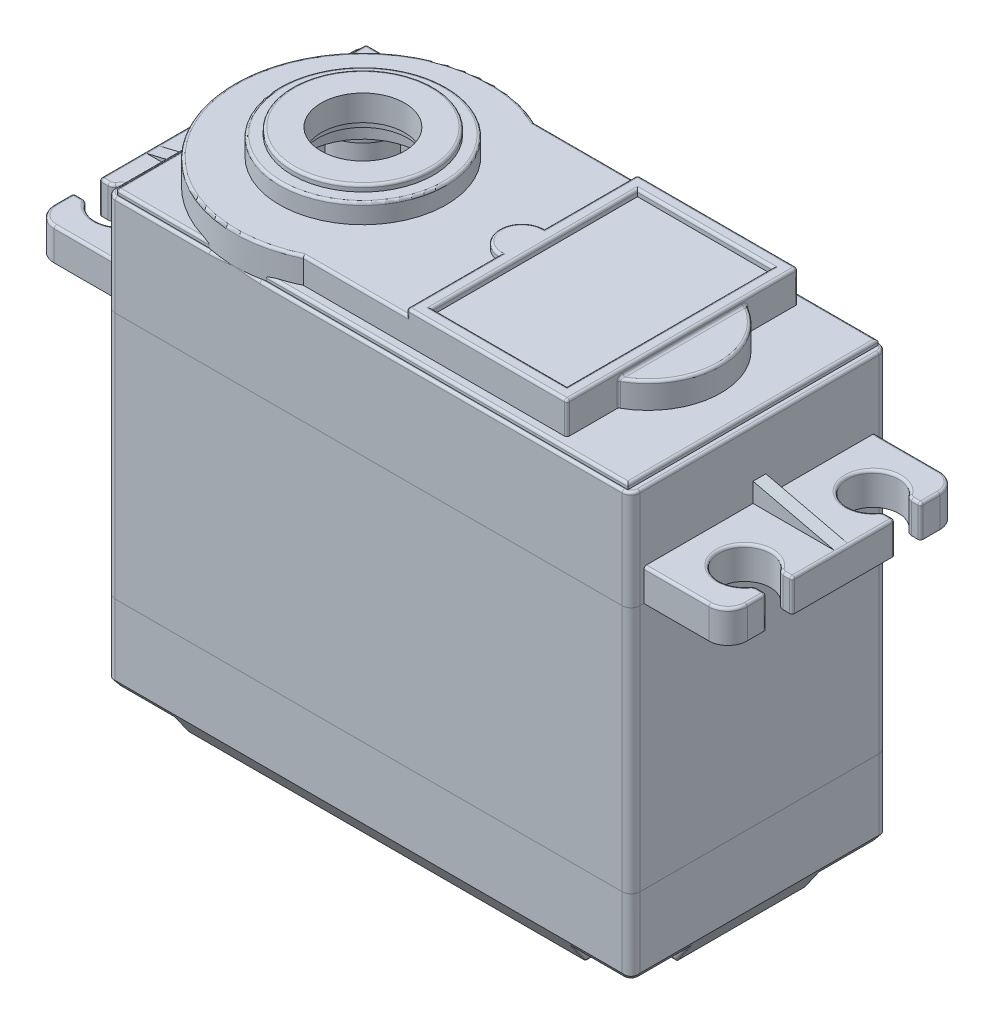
SolidWorks part; units mm, degrees
ref_plane "Front Plane" through (0, 0, 0) normal (0, 0, 1) x (1, 0, 0)
ref_plane "Top Plane" through (0, 0, 0) normal (0, 1, 0) x (1, 0, 0)
ref_plane "Right Plane" through (0, 0, 0) normal (1, 0, 0) x (0, 0, -1)
sketch "Sketch2" plane through (0, 0, 0) normal (0, 1, 0) x (1, 0, 0)
  line L1 (20.45, -10) -> (-20.45, -10)
  line L2 (20.45, -10) -> (20.45, 10)
  line L3 (20.45, 10) -> (-20.45, 10)
  line L4 (-20.45, -10) -> (-20.45, 10)
  line L5 (20.45, -10) -> (-20.45, 10) construction
  line L6 (20.45, 10) -> (-20.45, -10) construction
  point P0 (0, 0)
extrude "Boss-Extrude2" add sketch "Sketch2" along normal mid plane 19.3
sketch "Sketch11" plane through (0, 9.65, 0) normal (0, 1, 0) x (1, 0, 0)
  line L4 (-20.45, 10) -> (-20.45, -10)
  line L5 (-20.45, -10) -> (20.45, -10)
  line L6 (20.45, -10) -> (20.45, 10)
  line L7 (20.45, 10) -> (-20.45, 10)
  line L8 (-20.45, 10) -> (-20.45, -10)
  line L9 (-20.45, -10) -> (20.45, -10)
  line L10 (20.45, -10) -> (20.45, 10)
  line L11 (20.45, 10) -> (-20.45, 10)
  dimension "D1" = 0
extrude "Boss-Extrude10" add sketch "Sketch11" along normal blind 6.8 separate body
sketch "Sketch12" plane through (0, -9.65, 0) normal (0, -1, 0) x (1, 0, 0)
  line L4 (-20.45, 10) -> (-20.45, -10)
  line L5 (-20.45, -10) -> (20.45, -10)
  line L6 (20.45, -10) -> (20.45, 10)
  line L7 (20.45, 10) -> (-20.45, 10)
  line L8 (-20.45, 10) -> (-20.45, -10)
  line L9 (-20.45, -10) -> (20.45, -10)
  line L10 (20.45, -10) -> (20.45, 10)
  line L11 (20.45, 10) -> (-20.45, 10)
  dimension "D1" = 0
extrude "Boss-Extrude11" add sketch "Sketch12" along normal blind 8.5 separate body
chamfer "Chamfer1" distance 2 angle 35 4 edges at (20.45, -18.15, 0) (0, -18.15, -10) (-20.45, -18.15, 0) (0, -18.15, 10)
sketch "Sketch13" plane through (0, -18.15, 0) normal (0, -1, 0) x (1, 0, 0)
  line L0 (-20.45, 10) -> (20.45, 10) construction
  line L1 (-17.575, -7.125) -> (17.575, -7.125) construction
  line L2 (-17.575, -7.125) -> (-17.575, 7.125) construction
  line L3 (-17.575, 7.125) -> (17.575, 7.125) construction
  line L4 (17.575, -7.125) -> (17.575, 7.125) construction
  line L5 (-17.575, -7.125) -> (17.575, 7.125) construction
  line L6 (-17.575, 7.125) -> (17.575, -7.125) construction
  line L11 (0, 10) -> (0, -10) construction
  line L12 (20.45, -10) -> (-20.45, -10) construction
  line L13 (-20.45, 10) -> (-15.575, 10)
  line L14 (-20.45, 10) -> (-20.45, 5.125)
  line L15 (-20.45, 5.125) -> (-17.575, 5.125)
  line L16 (-15.575, 10) -> (-15.575, 7.125)
  line L17 (-15.575, 6.3142) -> (-15.575, 5.125) construction
  line L18 (-17.575, 5.125) -> (-15.575, 5.125) construction
  line L23 (-20.45, 0) -> (20.45, 0) construction
  line L24 (20.45, 10) -> (20.45, -10) construction
  line L29 (20.45, 10) -> (20.45, 5.125)
  line L30 (20.45, 5.125) -> (17.575, 5.125)
  line L31 (-20.45, -10) -> (-20.45, 10) construction
  line L32 (-15.575, 7.125) -> (-15.575, 6.3142) construction
  line L33 (15.575, 10) -> (15.575, 7.125)
  line L34 (20.45, 10) -> (15.575, 10)
  line L35 (20.45, -10) -> (15.575, -10)
  line L36 (15.575, -10) -> (15.575, -7.125)
  line L37 (20.45, -5.125) -> (17.575, -5.125)
  line L38 (20.45, -10) -> (20.45, -5.125)
  line L39 (-20.45, -10) -> (-20.45, -5.125)
  line L40 (-20.45, -5.125) -> (-17.575, -5.125)
  line L41 (-15.575, -10) -> (-15.575, -7.125)
  line L42 (-20.45, -10) -> (-15.575, -10)
  circle A0 centre (-17.575, 7.125) radius 1.125 construction
  circle A1 centre (-17.575, 7.125) radius 1.6 construction
  arc A2 (-17.575, 5.125) -> (-15.575, 7.125) centre (-17.575, 7.125) ccw
  arc A3 (-15.575, 7.125) -> (-17.575, 5.125) centre (-17.575, 7.125) ccw construction
  arc A4 (17.575, 5.125) -> (15.575, 7.125) centre (17.575, 7.125) cw
  arc A5 (17.575, -5.125) -> (15.575, -7.125) centre (17.575, -7.125) ccw
  arc A6 (-17.575, -5.125) -> (-15.575, -7.125) centre (-17.575, -7.125) cw
  point P0 (0, 0)
  point P15 (0, 0)
  point P20 (0, 0)
  dimension "D1" = 1.75
  dimension "D2" = 2.25
  dimension "D3" = 3.2
  dimension "D4" = 1.75
  dimension "D5" = 4
extrude "Cut-Extrude1" cut sketch "Sketch13" against normal blind 1.5
sketch "Sketch14" plane through (0, -16.65, 0) normal (0, -1, 0) x (1, 0, 0)
  line L20 (0, 10) -> (0, -10) construction
  line L21 (20.45, -10) -> (-20.45, -10) construction
  line L22 (-20.45, 0) -> (20.45, 0) construction
  line L23 (20.45, 10) -> (20.45, -10) construction
  circle A4 centre (-17.575, 7.125) radius 1.125
  circle A5 centre (17.575, 7.125) radius 1.125
  circle A6 centre (17.575, -7.125) radius 1.125
  circle A7 centre (-17.575, -7.125) radius 1.125
  point P4 (0, 0)
  point P16 (0, 0)
  dimension "D1" = 2.25
extrude "Cut-Extrude2" cut sketch "Sketch14" against normal offset from surface (30.1 mm away) 3
sketch "Sketch25" plane through (0, 16.45, 0) normal (0, 1, 0) x (1, 0, 0)
  line L0 (20.45, 10) -> (-20.45, 10) construction
  line L1 (19.95, -9.75) -> (-19.95, -9.75)
  line L2 (19.95, -9.75) -> (19.95, 9.75)
  line L3 (19.95, 9.75) -> (-19.95, 9.75)
  line L4 (-19.95, -9.75) -> (-19.95, 9.75)
  line L5 (19.95, -9.75) -> (-19.95, 9.75) construction
  line L6 (19.95, 9.75) -> (-19.95, -9.75) construction
  line L7 (-20.45, 10) -> (-20.45, -10) construction
  point P0 (0, 0)
  dimension "D1" = 0.25
  dimension "D2" = 0.5
extrude "Boss-Extrude12" add sketch "Sketch25" along normal blind 0.4
sketch "Sketch26" plane through (0, 16.85, 0) normal (0, 1, 0) x (1, 0, 0)
  line L0 (20.45, 0) -> (-20.45, 0) construction
  line L5 (14.45, 9) -> (-6.0911, 9)
  line L6 (14.45, -9) -> (-6.0911, -9)
  line L7 (14.45, 9) -> (14.45, 5)
  line L8 (14.45, -9) -> (14.45, -5)
  line L10 (20.45, -10) -> (20.45, 10) construction
  line L11 (-20.45, -10) -> (20.45, -10) construction
  line L13 (-20.45, 10) -> (-20.45, -10) construction
  arc A2 (-6.0911, 9) -> (-6.0911, -9) centre (-10.45, 0) ccw
  arc A3 (14.45, 5) -> (14.45, -5) centre (11.7833, 0) cw
  point P3 (0, 0)
  point P11 (17.45, 0)
  point P18 (20.45, 0)
extrude "Boss-Extrude13" add sketch "Sketch26" along normal blind 2 and the other way up to surface
sketch "Sketch27" plane through (0, 18.85, 0) normal (0, 1, 0) x (1, 0, 0)
  circle A0 centre (-10.45, 0) radius 6.5
  dimension "D1" = 13
extrude "Boss-Extrude14" add sketch "Sketch27" along normal blind 1.5
sketch "Sketch28" plane through (0, 20.35, 0) normal (0, 1, 0) x (1, 0, 0)
  circle A0 centre (-10.45, 0) radius 5.5
  dimension "D1" = 11
extrude "Boss-Extrude15" add sketch "Sketch28" along normal blind 0.5
sketch "Sketch29" plane through (0, 18.85, 0) normal (0, 1, 0) x (1, 0, 0)
  line L0 (-6.0911, -9) -> (14.45, -9) construction
  line L1 (14.45, 9) -> (1.95, 9)
  line L2 (14.45, 9) -> (14.45, -9)
  line L3 (14.45, -9) -> (1.95, -9)
  line L4 (1.95, 9) -> (1.95, 1.75)
  line L5 (2.95, 8) -> (2.95, -8)
  line L6 (13.45, -8) -> (2.95, -8)
  line L7 (13.45, 8) -> (13.45, -8)
  line L8 (13.45, 8) -> (2.95, 8)
  line L9 (1.95, 1.75) -> (1.95, -1.75) construction
  line L10 (1.95, -1.75) -> (1.95, -9)
  line L11 (1.95, 9) -> (1.95, -9) construction
  arc A1 (1.95, -1.75) -> (1.95, 1.75) centre (1.95, 0) cw
  point P19 (1.95, 0)
  dimension "D2" = 3.5
  dimension "D1" = 12.5
  dimension "D3" = 1
extrude "Boss-Extrude16" add sketch "Sketch29" along normal blind 0.5
fillet "Fillet9" radius 0.2 39 edges at (14.45, 17.85, 5) (14.45, 17.85, -5) (14.45, 18.85, 0) (-20.45, 16.45, -5) (-15.45, 16.45, -10) (-15.45, 16.45, 10) (2.95, 19.35, 0) (8.2, 19.35, 8) (13.45, 19.35, 0) (8.2, 19.35, -8) (8.2, 19.35, 9) (1.95, 19.35, 5.375) (0.2, 19.35, 0) (1.95, 19.35, -5.375) (8.2, 19.35, -9) (14.45, 19.35, 0) (-10.45, 20.35, 6.5) (-10.45, 20.85, 5.5) (1.95, 19.1, 9) (1.95, 19.1, -9) (-16.311, 16.85, -9.75) (-19.95, 16.65, 9.75) (-16.311, 16.85, 9.75) (-19.95, 16.65, -9.75) (-19.95, 16.85, -6.4362) (-19.95, 16.85, 6.4362) (-20.45, 16.45, 5) (-2.0706, 18.85, 9) (-20.45, 18.85, 0) (-2.0706, 18.85, -9) (14.45, 18.1, -9) (14.45, 18.1, 9) (17.45, 18.85, 0) (5, 16.45, -10) (5.861, 16.85, -9.75) (20.45, 16.45, 0) (5, 16.45, 10) (5.861, 16.85, 9.75) (19.95, 16.85, 0)
fillet "Fillet10" radius 0.7 8 edges at (20.3914, 16.3914, 9.9414) (-20.3914, 16.3914, 9.9414) (20.3914, 16.3914, -9.9414) (-20.3914, 16.3914, -9.9414) (-20.45, 12.95, -10) (20.45, 12.95, -10) (-20.45, 12.95, 10) (20.45, 12.95, 10)
fillet "Fillet11" radius 0.7 4 edges at (-20.45, 0, 10) (20.45, 0, -10) (-20.45, 0, -10) (20.45, 0, 10)
fillet "Fillet12" radius 0.7 8 edges at (-20.45, -12.9, 10) (-20.45, -12.9, -10) (20.45, -12.9, -10) (20.45, -12.9, 10) (-20.2749, -16.4, -9.8249) (-20.2749, -16.4, 9.8249) (20.2749, -16.4, -9.8249) (20.2749, -16.4, 9.8249)
shell "Shell1" thickness 2
sketch "Sketch45" plane through (0, -9.65, 0) normal (0, 1, 0) x (1, 0, 0)
  line L1 (-15.5021, 8) -> (-14.575, 8)
  line L2 (-18.45, 5.0521) -> (-18.45, 4.125)
  line L5 (-18.45, -4.125) -> (-18.45, 4.125) construction
  line L6 (-14.575, 8) -> (14.575, 8) construction
  line L8 (0, 10) -> (0, -10) construction
  line L10 (19.75, -10) -> (-19.75, -10) construction
  line L14 (-20.45, 0) -> (20.45, 0) construction
  line L16 (20.45, 9.3) -> (20.45, -9.3) construction
  line L18 (18.45, 5.0521) -> (18.45, 4.125)
  line L20 (-18.45, 8) -> (-18.2821, 8) construction
  line L21 (-18.45, 8) -> (-18.45, 7.8321) construction
  line L22 (-18.2821, 8) -> (-16.8679, 8) construction
  line L23 (-18.45, 7.8321) -> (-18.45, 6.4179) construction
  line L24 (-16.8679, 8) -> (-15.5021, 8) construction
  line L25 (-18.45, 6.4179) -> (-18.45, 5.0521) construction
  line L32 (15.5021, 8) -> (14.575, 8)
  line L40 (18.45, -5.0521) -> (18.45, -4.125)
  line L41 (15.5021, -8) -> (14.575, -8)
  line L42 (-18.45, -5.0521) -> (-18.45, -4.125)
  line L43 (-15.5021, -8) -> (-14.575, -8)
  arc A7 (-18.45, 6.4179) -> (-16.8679, 8) centre (-17.575, 7.125) ccw construction
  arc A8 (-18.45, 5.0521) -> (-15.5021, 8) centre (-17.575, 7.125) ccw
  arc A20 (18.45, 4.125) -> (14.575, 8) centre (17.575, 7.125) cw
  arc A21 (18.45, 5.0521) -> (15.5021, 8) centre (17.575, 7.125) cw
  arc A23 (18.45, -5.0521) -> (15.5021, -8) centre (17.575, -7.125) ccw
  arc A26 (-15.5021, 8) -> (-18.45, 5.0521) centre (-17.575, 7.125) ccw construction
  circle A27 centre (-17.575, 7.125) radius 2.25 construction
  arc A28 (-16.8679, 8) -> (-18.2821, 8) centre (-17.575, 7.125) ccw construction
  circle A29 centre (-17.575, 7.125) radius 1.125 construction
  arc A30 (-18.2821, 8) -> (-18.45, 7.8321) centre (-17.575, 7.125) ccw construction
  arc A31 (-18.45, 7.8321) -> (-18.45, 6.4179) centre (-17.575, 7.125) ccw construction
  arc A33 (18.45, -4.125) -> (14.575, -8) centre (17.575, -7.125) ccw
  arc A35 (-18.45, -4.125) -> (-14.575, -8) centre (-17.575, -7.125) cw
  arc A39 (-18.45, -5.0521) -> (-15.5021, -8) centre (-17.575, -7.125) cw
  arc A46 (-18.45, 4.125) -> (-14.575, 8) centre (-17.575, 7.125) ccw construction
  arc A47 (-18.45, 4.125) -> (-14.575, 8) centre (-17.575, 7.125) ccw
  circle A52 centre (-17.575, 7.125) radius 1.125 construction
  point P5 (0, 0)
  point P14 (0, 0)
  dimension "D1" = 1.125
extrude "Cut-Extrude7" cut sketch "Sketch45" against normal up to surface (5 mm away)
sketch "Sketch32" plane through (0, -9.65, 0) normal (0, 1, 0) x (1, 0, 0)
  line L16 (-19.75, 10) -> (19.75, 10) construction
  line L17 (-18.975, 9.125) -> (18.975, 9.125)
  line L18 (-19.575, 8.525) -> (-19.575, -8.525)
  line L19 (-18.975, -9.125) -> (18.975, -9.125)
  line L20 (19.575, 8.525) -> (19.575, -8.525)
  line L21 (-20.45, -9.3) -> (-20.45, 9.3) construction
  line L26 (-20.45, 9.3) -> (-20.45, -9.3)
  line L27 (-19.75, -10) -> (19.75, -10)
  line L28 (20.45, -9.3) -> (20.45, 9.3)
  line L29 (19.75, 10) -> (-19.75, 10)
  line L30 (-20.45, 9.3) -> (-20.45, -9.3)
  line L31 (-19.75, -10) -> (19.75, -10)
  line L32 (20.45, -9.3) -> (20.45, 9.3)
  line L33 (19.75, 10) -> (-19.75, 10)
  arc A41 (18.975, -9.125) -> (19.575, -8.525) centre (18.975, -8.525) ccw
  arc A42 (-19.575, -8.525) -> (-18.975, -9.125) centre (-18.975, -8.525) ccw
  arc A43 (18.975, 9.125) -> (19.575, 8.525) centre (18.975, 8.525) cw
  arc A44 (-18.975, 9.125) -> (-19.575, 8.525) centre (-18.975, 8.525) ccw
  arc A49 (-20.45, -9.3) -> (-19.75, -10) centre (-19.75, -9.3) ccw
  arc A51 (-20.45, -9.3) -> (-19.75, -10) centre (-19.75, -9.3) ccw
  arc A57 (19.75, -10) -> (20.45, -9.3) centre (19.75, -9.3) ccw
  arc A59 (19.75, -10) -> (20.45, -9.3) centre (19.75, -9.3) ccw
  arc A61 (20.45, 9.3) -> (19.75, 10) centre (19.75, 9.3) ccw
  arc A62 (20.45, 9.3) -> (19.75, 10) centre (19.75, 9.3) ccw
  arc A63 (-19.75, 10) -> (-20.45, 9.3) centre (-19.75, 9.3) ccw
  arc A64 (-19.75, 10) -> (-20.45, 9.3) centre (-19.75, 9.3) ccw
  point P10 (0, 9.125)
  point P11 (19.575, 0)
  dimension "D3" = 0.6
  dimension "D1" = 0.875
  dimension "D2" = 0.875
  dimension "D4" = 0
extrude "Cut-Extrude6" cut sketch "Sketch32" against normal blind 1
shell "Shell2" thickness 2
sketch "Sketch36" plane through (0, 9.65, 0) normal (0, 1, 0) x (1, 0, 0)
  line L0 (-15.5021, 8) -> (15.5021, 8)
  line L1 (-18.45, 5.0521) -> (-18.45, -5.0521)
  line L2 (-15.5021, -8) -> (15.5021, -8)
  line L3 (18.45, 5.0521) -> (18.45, -5.0521)
  line L20 (18.975, 9.125) -> (-18.975, 9.125)
  line L21 (19.575, -8.525) -> (19.575, 8.525)
  line L22 (-18.975, -9.125) -> (18.975, -9.125)
  line L23 (-19.575, 8.525) -> (-19.575, -8.525)
  line L24 (18.975, 9.125) -> (-18.975, 9.125)
  line L25 (19.575, -8.525) -> (19.575, 8.525)
  line L26 (-18.975, -9.125) -> (18.975, -9.125)
  line L27 (-19.575, 8.525) -> (-19.575, -8.525)
  line L28 (19.75, 10) -> (-19.75, 10)
  line L29 (-20.45, 9.3) -> (-20.45, -9.3)
  line L30 (-19.75, -10) -> (19.75, -10)
  line L31 (20.45, -9.3) -> (20.45, 9.3)
  line L32 (19.75, 10) -> (-19.75, 10)
  line L33 (-20.45, 9.3) -> (-20.45, -9.3)
  line L34 (-19.75, -10) -> (19.75, -10)
  line L35 (20.45, -9.3) -> (20.45, 9.3)
  arc A0 (-18.45, 5.0521) -> (-15.5021, 8) centre (-17.575, 7.125) ccw construction
  arc A1 (-18.45, 5.0521) -> (-15.5021, 8) centre (-17.575, 7.125) ccw
  arc A4 (19.575, 8.525) -> (18.975, 9.125) centre (18.975, 8.525) ccw
  arc A5 (18.975, -9.125) -> (19.575, -8.525) centre (18.975, -8.525) ccw
  arc A6 (-19.575, -8.525) -> (-18.975, -9.125) centre (-18.975, -8.525) ccw
  arc A7 (-18.975, 9.125) -> (-19.575, 8.525) centre (-18.975, 8.525) ccw
  arc A8 (19.575, 8.525) -> (18.975, 9.125) centre (18.975, 8.525) ccw
  arc A9 (18.975, -9.125) -> (19.575, -8.525) centre (18.975, -8.525) ccw
  arc A10 (-19.575, -8.525) -> (-18.975, -9.125) centre (-18.975, -8.525) ccw
  arc A11 (-18.975, 9.125) -> (-19.575, 8.525) centre (-18.975, 8.525) ccw
  arc A80 (-15.5021, -8) -> (-18.45, -5.0521) centre (-17.575, -7.125) ccw construction
  arc A81 (-15.5021, -8) -> (-18.45, -5.0521) centre (-17.575, -7.125) ccw
  arc A82 (15.5021, 8) -> (18.45, 5.0521) centre (17.575, 7.125) ccw construction
  arc A83 (15.5021, 8) -> (18.45, 5.0521) centre (17.575, 7.125) ccw
  arc A84 (18.45, -5.0521) -> (15.5021, -8) centre (17.575, -7.125) ccw construction
  arc A85 (18.45, -5.0521) -> (15.5021, -8) centre (17.575, -7.125) ccw
  arc A86 (-19.75, 10) -> (-20.45, 9.3) centre (-19.75, 9.3) ccw
  arc A88 (-19.75, 10) -> (-20.45, 9.3) centre (-19.75, 9.3) ccw
  arc A90 (-20.45, -9.3) -> (-19.75, -10) centre (-19.75, -9.3) ccw
  arc A92 (-20.45, -9.3) -> (-19.75, -10) centre (-19.75, -9.3) ccw
  arc A94 (19.75, -10) -> (20.45, -9.3) centre (19.75, -9.3) ccw
  arc A95 (19.75, -10) -> (20.45, -9.3) centre (19.75, -9.3) ccw
  arc A96 (20.45, 9.3) -> (19.75, 10) centre (19.75, 9.3) ccw
  arc A97 (20.45, 9.3) -> (19.75, 10) centre (19.75, 9.3) ccw
  dimension "D1" = 0
  dimension "D2" = 0
extrude "Cut-Extrude3" cut sketch "Sketch36" against normal blind 1
sketch "Sketch47" plane through (0, -9.65, 0) normal (0, -1, 0) x (1, 0, 0)
  line L3 (18.45, 4.125) -> (18.45, 5.0521)
  line L7 (15.5021, 8) -> (14.575, 8)
  line L11 (18.45, 4.125) -> (18.45, 5.0521)
  line L15 (15.5021, 8) -> (14.575, 8)
  line L18 (18.45, -5.0521) -> (18.45, -4.125)
  line L19 (14.575, -8) -> (15.5021, -8)
  line L20 (18.45, -5.0521) -> (18.45, -4.125)
  line L21 (14.575, -8) -> (15.5021, -8)
  line L22 (-18.45, 5.0521) -> (-18.45, 4.125)
  line L23 (-14.575, 8) -> (-15.5021, 8)
  line L24 (-18.45, 5.0521) -> (-18.45, 4.125)
  line L25 (-14.575, 8) -> (-15.5021, 8)
  line L26 (-15.5021, -8) -> (-14.575, -8)
  line L27 (-18.45, -4.125) -> (-18.45, -5.0521)
  line L28 (-15.5021, -8) -> (-14.575, -8)
  line L29 (-18.45, -4.125) -> (-18.45, -5.0521)
  arc A19 (14.575, 8) -> (18.45, 4.125) centre (17.575, 7.125) ccw
  arc A20 (15.5021, 8) -> (18.45, 5.0521) centre (17.575, 7.125) ccw
  arc A21 (14.575, 8) -> (18.45, 4.125) centre (17.575, 7.125) ccw
  arc A22 (15.5021, 8) -> (18.45, 5.0521) centre (17.575, 7.125) ccw
  arc A23 (18.45, -4.125) -> (14.575, -8) centre (17.575, -7.125) ccw
  arc A24 (18.45, -5.0521) -> (15.5021, -8) centre (17.575, -7.125) ccw
  arc A25 (18.45, -4.125) -> (14.575, -8) centre (17.575, -7.125) ccw
  arc A26 (18.45, -5.0521) -> (15.5021, -8) centre (17.575, -7.125) ccw
  arc A27 (-18.45, 4.125) -> (-14.575, 8) centre (-17.575, 7.125) ccw
  arc A28 (-18.45, 5.0521) -> (-15.5021, 8) centre (-17.575, 7.125) ccw
  arc A29 (-18.45, 4.125) -> (-14.575, 8) centre (-17.575, 7.125) ccw
  arc A30 (-18.45, 5.0521) -> (-15.5021, 8) centre (-17.575, 7.125) ccw
  arc A31 (-14.575, -8) -> (-18.45, -4.125) centre (-17.575, -7.125) ccw
  arc A32 (-15.5021, -8) -> (-18.45, -5.0521) centre (-17.575, -7.125) ccw
  arc A33 (-14.575, -8) -> (-18.45, -4.125) centre (-17.575, -7.125) ccw
  arc A34 (-15.5021, -8) -> (-18.45, -5.0521) centre (-17.575, -7.125) ccw
  dimension "D1" = 0
  dimension "D2" = 0
  dimension "D3" = 0
  dimension "D4" = 0
extrude "Cut-Extrude9" cut sketch "Sketch47" against normal up to surface (17.3 mm away)
sketch "Sketch37" plane through (0, -9.65, 0) normal (0, -1, 0) x (1, 0, 0)
  line L12 (-18.975, -9.125) -> (18.975, -9.125)
  line L13 (19.575, -8.525) -> (19.575, 8.525)
  line L14 (18.975, 9.125) -> (-18.975, 9.125)
  line L15 (-19.575, 8.525) -> (-19.575, -8.525)
  line L16 (-18.975, -9.125) -> (18.975, -9.125)
  line L17 (19.575, -8.525) -> (19.575, 8.525)
  line L18 (18.975, 9.125) -> (-18.975, 9.125)
  line L19 (-19.575, 8.525) -> (-19.575, -8.525)
  line L20 (-19.75, -10) -> (19.75, -10)
  line L21 (-20.45, 9.3) -> (-20.45, -9.3)
  line L22 (19.75, 10) -> (-19.75, 10)
  line L23 (20.45, -9.3) -> (20.45, 9.3)
  line L24 (-19.75, -10) -> (19.75, -10)
  line L25 (-20.45, 9.3) -> (-20.45, -9.3)
  line L26 (19.75, 10) -> (-19.75, 10)
  line L27 (20.45, -9.3) -> (20.45, 9.3)
  arc A4 (18.975, -9.125) -> (19.575, -8.525) centre (18.975, -8.525) ccw
  arc A5 (19.575, 8.525) -> (18.975, 9.125) centre (18.975, 8.525) ccw
  arc A6 (-18.975, 9.125) -> (-19.575, 8.525) centre (-18.975, 8.525) ccw
  arc A7 (-19.575, -8.525) -> (-18.975, -9.125) centre (-18.975, -8.525) ccw
  arc A8 (18.975, -9.125) -> (19.575, -8.525) centre (18.975, -8.525) ccw
  arc A9 (19.575, 8.525) -> (18.975, 9.125) centre (18.975, 8.525) ccw
  arc A10 (-18.975, 9.125) -> (-19.575, 8.525) centre (-18.975, 8.525) ccw
  arc A11 (-19.575, -8.525) -> (-18.975, -9.125) centre (-18.975, -8.525) ccw
  arc A36 (-20.45, -9.3) -> (-19.75, -10) centre (-19.75, -9.3) ccw
  arc A38 (-20.45, -9.3) -> (-19.75, -10) centre (-19.75, -9.3) ccw
  arc A44 (-19.75, 10) -> (-20.45, 9.3) centre (-19.75, 9.3) ccw
  arc A46 (-19.75, 10) -> (-20.45, 9.3) centre (-19.75, 9.3) ccw
  arc A48 (20.45, 9.3) -> (19.75, 10) centre (19.75, 9.3) ccw
  arc A49 (20.45, 9.3) -> (19.75, 10) centre (19.75, 9.3) ccw
  arc A50 (19.75, -10) -> (20.45, -9.3) centre (19.75, -9.3) ccw
  arc A51 (19.75, -10) -> (20.45, -9.3) centre (19.75, -9.3) ccw
  dimension "D1" = 0
  dimension "D2" = 0
extrude "Boss-Extrude24" add sketch "Sketch37" along normal blind 1
shell "Shell3" thickness 2
sketch "Sketch50" plane through (0, 9.65, 0) normal (0, -1, 0) x (1, 0, 0)
  line L3 (18.45, 4.125) -> (18.45, 5.0521)
  line L7 (15.5021, 8) -> (14.575, 8)
  line L11 (18.45, 4.125) -> (18.45, 5.0521)
  line L15 (15.5021, 8) -> (14.575, 8)
  line L18 (18.45, -5.0521) -> (18.45, -4.125)
  line L19 (14.575, -8) -> (15.5021, -8)
  line L20 (18.45, -5.0521) -> (18.45, -4.125)
  line L21 (14.575, -8) -> (15.5021, -8)
  line L22 (-18.45, 5.0521) -> (-18.45, 4.125)
  line L23 (-14.575, 8) -> (-15.5021, 8)
  line L24 (-18.45, 5.0521) -> (-18.45, 4.125)
  line L25 (-14.575, 8) -> (-15.5021, 8)
  line L26 (-15.5021, -8) -> (-14.575, -8)
  line L27 (-18.45, -4.125) -> (-18.45, -5.0521)
  line L28 (-15.5021, -8) -> (-14.575, -8)
  line L29 (-18.45, -4.125) -> (-18.45, -5.0521)
  arc A19 (14.575, 8) -> (18.45, 4.125) centre (17.575, 7.125) ccw
  arc A20 (15.5021, 8) -> (18.45, 5.0521) centre (17.575, 7.125) ccw
  arc A21 (14.575, 8) -> (18.45, 4.125) centre (17.575, 7.125) ccw
  arc A22 (15.5021, 8) -> (18.45, 5.0521) centre (17.575, 7.125) ccw
  arc A23 (18.45, -4.125) -> (14.575, -8) centre (17.575, -7.125) ccw
  arc A24 (18.45, -5.0521) -> (15.5021, -8) centre (17.575, -7.125) ccw
  arc A25 (18.45, -4.125) -> (14.575, -8) centre (17.575, -7.125) ccw
  arc A26 (18.45, -5.0521) -> (15.5021, -8) centre (17.575, -7.125) ccw
  arc A27 (-18.45, 4.125) -> (-14.575, 8) centre (-17.575, 7.125) ccw
  arc A28 (-18.45, 5.0521) -> (-15.5021, 8) centre (-17.575, 7.125) ccw
  arc A29 (-18.45, 4.125) -> (-14.575, 8) centre (-17.575, 7.125) ccw
  arc A30 (-18.45, 5.0521) -> (-15.5021, 8) centre (-17.575, 7.125) ccw
  arc A31 (-14.575, -8) -> (-18.45, -4.125) centre (-17.575, -7.125) ccw
  arc A32 (-15.5021, -8) -> (-18.45, -5.0521) centre (-17.575, -7.125) ccw
  arc A33 (-14.575, -8) -> (-18.45, -4.125) centre (-17.575, -7.125) ccw
  arc A34 (-15.5021, -8) -> (-18.45, -5.0521) centre (-17.575, -7.125) ccw
  dimension "D1" = 0
  dimension "D2" = 0
  dimension "D3" = 0
  dimension "D4" = 0
extrude "Cut-Extrude11" cut sketch "Sketch50" against normal up to surface (5.2 mm away)
sketch "Sketch39" plane through (0, 9.65, 0) normal (0, -1, 0) x (1, 0, 0)
  line L5 (-18.975, -9.125) -> (18.975, -9.125)
  line L6 (19.575, -8.525) -> (19.575, 8.525)
  line L7 (18.975, 9.125) -> (-18.975, 9.125)
  line L13 (-19.575, 8.525) -> (-19.575, -8.525)
  line L14 (-18.975, -9.125) -> (18.975, -9.125)
  line L15 (19.575, -8.525) -> (19.575, 8.525)
  line L20 (18.975, 9.125) -> (-18.975, 9.125)
  line L21 (-19.575, 8.525) -> (-19.575, -8.525)
  line L22 (19.75, 10) -> (-19.75, 10)
  line L23 (20.45, -9.3) -> (20.45, 9.3)
  line L24 (-19.75, -10) -> (19.75, -10)
  line L25 (-20.45, 9.3) -> (-20.45, -9.3)
  line L26 (19.75, 10) -> (-19.75, 10)
  line L27 (20.45, -9.3) -> (20.45, 9.3)
  line L28 (-19.75, -10) -> (19.75, -10)
  line L29 (-20.45, 9.3) -> (-20.45, -9.3)
  arc A4 (18.975, -9.125) -> (19.575, -8.525) centre (18.975, -8.525) ccw
  arc A5 (19.575, 8.525) -> (18.975, 9.125) centre (18.975, 8.525) ccw
  arc A6 (-18.975, 9.125) -> (-19.575, 8.525) centre (-18.975, 8.525) ccw
  arc A7 (-19.575, -8.525) -> (-18.975, -9.125) centre (-18.975, -8.525) ccw
  arc A8 (18.975, -9.125) -> (19.575, -8.525) centre (18.975, -8.525) ccw
  arc A9 (19.575, 8.525) -> (18.975, 9.125) centre (18.975, 8.525) ccw
  arc A10 (-18.975, 9.125) -> (-19.575, 8.525) centre (-18.975, 8.525) ccw
  arc A11 (-19.575, -8.525) -> (-18.975, -9.125) centre (-18.975, -8.525) ccw
  arc A20 (-19.75, 10) -> (-20.45, 9.3) centre (-19.75, 9.3) ccw
  arc A21 (-19.75, 10) -> (-20.45, 9.3) centre (-19.75, 9.3) ccw
  arc A22 (-20.45, -9.3) -> (-19.75, -10) centre (-19.75, -9.3) ccw
  arc A23 (-20.45, -9.3) -> (-19.75, -10) centre (-19.75, -9.3) ccw
  arc A24 (19.75, -10) -> (20.45, -9.3) centre (19.75, -9.3) ccw
  arc A25 (19.75, -10) -> (20.45, -9.3) centre (19.75, -9.3) ccw
  arc A26 (20.45, 9.3) -> (19.75, 10) centre (19.75, 9.3) ccw
  arc A27 (20.45, 9.3) -> (19.75, 10) centre (19.75, 9.3) ccw
  dimension "D1" = 0
  dimension "D2" = 0
extrude "Boss-Extrude22" add sketch "Sketch39" along normal blind 1
sketch "Sketch40" plane through (0, 20.85, 0) normal (0, 1, 0) x (1, 0, 0)
  circle A0 centre (-10.45, 0) radius 3.25
  dimension "D1" = 6.5
extrude "Cut-Extrude5" cut sketch "Sketch40" against normal up to next
sketch "Sketch8" plane through (0, 8.65, 6.75) normal (0, -1, 0) x (1, 0, 0)
  line L0 (20.45, -6.75) -> (0, -6.75) construction
  line L1 (20.45, 2.55) -> (20.45, -16.05) construction
  line L2 (20.45, 2.25) -> (25.5, 2.25)
  line L6 (25.5, -15.75) -> (20.45, -15.75)
  line L9 (20.45, -6.75) -> (27, -6.75) construction
  line L10 (20.45, -15.75) -> (20.45, 2.25)
  line L11 (24.3, -1.75) -> (24.3, -6.75) construction
  line L12 (24.3, -6.75) -> (24.3, -11.75) construction
  line L13 (27, 0.75) -> (27, -0.55)
  line L14 (26.3, -0.75) -> (26.8, -0.75)
  line L15 (26.3, -12.75) -> (26.8, -12.75)
  line L16 (26.3, -2.75) -> (26.8, -2.75)
  line L17 (26.3, -10.75) -> (26.8, -10.75)
  line L20 (27, -12.95) -> (27, -14.25)
  line L21 (27, -2.95) -> (27, -10.55)
  line L22 (0, 3.25) -> (0, -16.75) construction
  line L23 (-19.75, 3.25) -> (19.75, 3.25) construction
  line L24 (19.75, -16.75) -> (-19.75, -16.75) construction
  arc A0 (25.9, -0.55) -> (25.9, -2.95) centre (24.3, -1.75) ccw
  arc A1 (25.9, -10.55) -> (25.9, -12.95) centre (24.3, -11.75) ccw
  arc A2 (26.3, -12.75) -> (25.9, -12.95) centre (26.3, -13.25) ccw
  arc A3 (26.3, -10.75) -> (25.9, -10.55) centre (26.3, -10.25) cw
  arc A4 (26.3, -2.75) -> (25.9, -2.95) centre (26.3, -3.25) ccw
  arc A5 (26.3, -0.75) -> (25.9, -0.55) centre (26.3, -0.25) cw
  arc A6 (25.5, 2.25) -> (27, 0.75) centre (25.5, 0.75) cw
  arc A7 (27, -14.25) -> (25.5, -15.75) centre (25.5, -14.25) cw
  arc A8 (26.8, -12.75) -> (27, -12.95) centre (26.8, -12.95) cw
  arc A9 (26.8, -10.75) -> (27, -10.55) centre (26.8, -10.55) ccw
  arc A10 (26.8, -2.75) -> (27, -2.95) centre (26.8, -2.95) cw
  arc A11 (26.8, -0.75) -> (27, -0.55) centre (26.8, -0.55) ccw
  point P24 (20.45, -6.75)
  point P28 (26.0321, -12.75)
  point P31 (26.0321, -10.75)
  point P34 (26.0321, -2.75)
  point P37 (26.0321, -0.75)
  point P57 (27, -12.75)
  point P60 (27, -10.75)
  point P63 (27, -2.75)
  point P66 (27, -0.75)
extrude "Boss-Extrude8" add sketch "Sketch8" against normal blind 2.5
sketch "Sketch9" plane through (0, 0, 0) normal (0, 0, 1) x (1, 0, 0)
  line L0 (26.8, 11.15) -> (20.45, 12.65)
  line L4 (25.5, 11.15) -> (20.45, 11.15) construction
  line L5 (27, 11.15) -> (25.5, 11.15) construction
  dimension "D1" = 1.5
  dimension "D2" = 0.2
  dimension "D3" = 20.45
rib "Rib1" sketch "Sketch9" sketch "Sketch9" thickness 1 extrusion direction parallel to sketch draft on no parameters "D1"=1
fillet "Fillet22" radius 0.2 21 edges at (22.975, 11.15, -9) (26.5607, 11.15, -8.5607) (27, 11.15, -6.85) (26.9414, 11.15, -6.0586) (26.55, 11.15, -6) (26.0764, 11.15, -6.0528) (22.3, 11.15, -5) (26.0764, 11.15, -3.9472) (26.55, 11.15, -4) (26.9414, 11.15, -3.9414) (27, 11.15, 0) (26.9414, 11.15, 3.9414) (26.55, 11.15, 4) (26.0764, 11.15, 3.9472) (22.3, 11.15, 5) (26.0764, 11.15, 6.0528) (26.55, 11.15, 6) (26.9414, 11.15, 6.0586) (27, 11.15, 6.85) (26.5607, 11.15, 8.5607) (22.975, 11.15, 9)
mirror "Mirror1" about plane through (0, 0, 0) normal (1, 0, 0) of "Fillet22", "Rib1", "Boss-Extrude8"
sketch "Sketch48" plane through (0, 8.65, 0) normal (0, 1, 0) x (1, 0, 0)
  circle A0 centre (-10.45, 0) radius 1.75
  dimension "D1" = 3.5
extrude "Cut-Extrude10" cut sketch "Sketch48" against normal up to next
fillet "Fillet24" radius 0.2 35 edges at (20.0999, -16.65, 7.1007) (19.9419, -16.65, 9.4919) (15.575, -18.15, 7.8623) (16.1608, -18.15, 5.7108) (17.5507, -16.65, -9.6499) (19.9419, -16.65, -9.4919) (18.3123, -18.15, -5.125) (16.1608, -18.15, -5.7108) (-17.5507, -16.65, -9.6499) (-19.9419, -16.65, -9.4919) (-15.575, -18.15, -7.8623) (-18.3123, -18.15, -5.125) (-20.0999, -16.65, 7.1007) (-19.9419, -16.65, 9.4919) (-18.3123, -18.15, 5.125) (-16.1608, -18.15, 5.7108) (17.5507, -16.65, 9.6499) (15.575, -17.4, 9.1247) (18.3123, -18.15, 5.125) (19.5747, -17.4, 5.125) (20.0999, -16.65, -7.1007) (19.5747, -17.4, -5.125) (15.575, -18.15, -7.8623) (15.575, -17.4, -9.1247) (0, -18.15, -8.5996) (-15.575, -17.4, -9.1247) (-20.0999, -16.65, -7.1007) (-19.5747, -17.4, -5.125) (-16.1608, -18.15, -5.7108) (-17.5507, -16.65, 9.6499) (0, -18.15, 8.5996) (-19.0496, -18.15, 0) (-15.575, -17.4, 9.1247) (-19.5747, -17.4, 5.125) (-15.575, -18.15, 7.8623)
sketch "Sketch52" plane through (0, 9.65, 0) normal (0, -1, 0) x (1, 0, 0)
  circle A0 centre (-17.575, 7.125) radius 0.8
  circle A1 centre (17.575, 7.125) radius 0.8
  circle A2 centre (17.575, 7.125) radius 1.125 construction
  circle A3 centre (17.575, 7.125) radius 1.125
  circle A4 centre (-17.575, 7.125) radius 1.125 construction
  circle A5 centre (-17.575, 7.125) radius 1.125
  circle A6 centre (-17.575, -7.125) radius 1.125 construction
  circle A7 centre (-17.575, -7.125) radius 1.125
  circle A8 centre (-17.575, -7.125) radius 0.8
  circle A9 centre (17.575, -7.125) radius 1.125 construction
  circle A10 centre (17.575, -7.125) radius 1.125
  circle A11 centre (17.575, -7.125) radius 0.8
  dimension "D1" = 1.6
extrude "Boss-Extrude26" add sketch "Sketch52" against normal up to surface (3.8 mm away)
sketch "Sketch53" plane through (0, -9.65, 0) normal (0, 1, 0) x (1, 0, 0)
  line L0 (-20.45, 9.3) -> (-20.45, -9.3) construction
  line L1 (-20.45, 2.9) -> (-18.45, 2.9)
  line L2 (-20.45, 2.9) -> (-20.45, -2.9)
  line L3 (-20.45, -2.9) -> (-18.45, -2.9)
  line L4 (-18.45, 2.9) -> (-18.45, -2.9)
  line L5 (-18.45, -5.0521) -> (-18.45, 5.0521) construction
  point P8 (-18.45, 0)
  dimension "D1" = 5.8
extrude "Cut-Extrude12" cut sketch "Sketch53" against normal blind 3.75
fillet "Fillet25" radius 0.8 2 edges at (-19.45, -13.4, 2.9) (-19.45, -13.4, -2.9)
chamfer "Chamfer2" distance 0.175 angle 30 4 edges at (-17.575, 9.65, -7.925) (17.575, 9.65, -7.925) (17.575, 9.65, 6.325) (-17.575, 9.65, 6.325)
thread "Thread1" pitch 0.35 start angle 0, offset 1, length 0, pitch 0.35, diameter 1.6
ref_plane "Plane1" through (-16.775, 8.751, 7.125) normal (0, 0, 1) x (1, 0, 0)
sketch "Thread Profile1" plane through (-16.775, 8.751, 7.125) normal (0, 0, 1) x (1, 0, 0)
  line L0 (0, 0) -> (0, 0.35) construction
  line L11 (0, 0) -> (0, 0.3062)
  line L12 (0, 0.3062) -> (-0.1894, 0.1969)
  line L13 (-0.1894, 0.1969) -> (-0.1894, 0.1094)
  line L15 (-0.1894, 0.1094) -> (0, 0)
  line L17 (-0.1894, 0.1531) -> (0, 0.1531) construction
  point P2 (0, 0)
  dimension "Pitch" = 0.35
  dimension "Profile_Angle" = 60
  dimension "Profile_Land" = 0.0875
  dimension "Profile_Height" = 0.1894
thread "Thread2" pitch 0.35 start angle 0, offset 1, length 0, pitch 0.35, diameter 1.6
ref_plane "Plane2" through (18.375, 8.751, 7.125) normal (0, 0, 1) x (1, 0, 0)
sketch "Thread Profile2" plane through (18.375, 8.751, 7.125) normal (0, 0, 1) x (1, 0, 0)
  line L0 (0, 0) -> (0, 0.35) construction
  line L11 (0, 0) -> (0, 0.3062)
  line L12 (0, 0.3062) -> (-0.1894, 0.1969)
  line L13 (-0.1894, 0.1969) -> (-0.1894, 0.1094)
  line L15 (-0.1894, 0.1094) -> (0, 0)
  line L17 (-0.1894, 0.1531) -> (0, 0.1531) construction
  point P2 (0, 0)
  dimension "Pitch" = 0.35
  dimension "Profile_Angle" = 60
  dimension "Profile_Land" = 0.0875
  dimension "Profile_Height" = 0.1894
thread "Thread3" pitch 0.35 start angle 0, offset 1, length 0, pitch 0.35, diameter 1.6
ref_plane "Plane3" through (18.375, 8.751, -7.125) normal (0, 0, 1) x (1, 0, 0)
sketch "Thread Profile3" plane through (18.375, 8.751, -7.125) normal (0, 0, 1) x (1, 0, 0)
  line L0 (0, 0) -> (0, 0.35) construction
  line L11 (0, 0) -> (0, 0.3062)
  line L12 (0, 0.3062) -> (-0.1894, 0.1969)
  line L13 (-0.1894, 0.1969) -> (-0.1894, 0.1094)
  line L15 (-0.1894, 0.1094) -> (0, 0)
  line L17 (-0.1894, 0.1531) -> (0, 0.1531) construction
  point P2 (0, 0)
  dimension "Pitch" = 0.35
  dimension "Profile_Angle" = 60
  dimension "Profile_Land" = 0.0875
  dimension "Profile_Height" = 0.1894
thread "Thread4" pitch 0.35 start angle 0, offset 1, length 0, pitch 0.35, diameter 1.6
ref_plane "Plane4" through (-16.775, 8.751, -7.125) normal (0, 0, 1) x (1, 0, 0)
sketch "Thread Profile4" plane through (-16.775, 8.751, -7.125) normal (0, 0, 1) x (1, 0, 0)
  line L0 (0, 0) -> (0, 0.35) construction
  line L11 (0, 0) -> (0, 0.3062)
  line L12 (0, 0.3062) -> (-0.1894, 0.1969)
  line L13 (-0.1894, 0.1969) -> (-0.1894, 0.1094)
  line L15 (-0.1894, 0.1094) -> (0, 0)
  line L17 (-0.1894, 0.1531) -> (0, 0.1531) construction
  point P2 (0, 0)
  dimension "Pitch" = 0.35
  dimension "Profile_Angle" = 60
  dimension "Profile_Land" = 0.0875
  dimension "Profile_Height" = 0.1894
sketch "Sketch55" plane through (0, 8.65, 0) normal (0, 1, 0) x (1, 0, 0)
  line L0 (-19.575, 8.525) -> (-19.575, -8.525) construction
  line L1 (-18.975, -9.125) -> (18.975, -9.125) construction
  line L2 (19.575, -8.525) -> (19.575, 8.525) construction
  line L3 (18.975, 9.125) -> (-18.975, 9.125) construction
  line L4 (-20.45, 9.3) -> (-20.45, -9.3)
  line L5 (-19.75, -10) -> (19.75, -10)
  line L6 (20.45, -9.3) -> (20.45, 9.3)
  line L7 (19.75, 10) -> (-19.75, 10)
  line L8 (-20.45, 9.3) -> (-20.45, -9.3)
  line L9 (-19.75, -10) -> (19.75, -10)
  line L10 (20.45, -9.3) -> (20.45, 9.3)
  line L11 (19.75, 10) -> (-19.75, 10)
  line L12 (-19.575, 8.525) -> (-19.575, -8.525)
  line L13 (-18.975, -9.125) -> (18.975, -9.125)
  line L14 (19.575, -8.525) -> (19.575, 8.525)
  line L15 (18.975, 9.125) -> (-18.975, 9.125)
  arc A0 (-18.975, 9.125) -> (-19.575, 8.525) centre (-18.975, 8.525) ccw construction
  arc A1 (-19.575, -8.525) -> (-18.975, -9.125) centre (-18.975, -8.525) ccw construction
  arc A2 (18.975, -9.125) -> (19.575, -8.525) centre (18.975, -8.525) ccw construction
  arc A3 (19.575, 8.525) -> (18.975, 9.125) centre (18.975, 8.525) ccw construction
  arc A4 (-19.75, 10) -> (-20.45, 9.3) centre (-19.75, 9.3) ccw
  arc A5 (-20.45, -9.3) -> (-19.75, -10) centre (-19.75, -9.3) ccw
  arc A6 (19.75, -10) -> (20.45, -9.3) centre (19.75, -9.3) ccw
  arc A7 (20.45, 9.3) -> (19.75, 10) centre (19.75, 9.3) ccw
  arc A8 (-19.75, 10) -> (-20.45, 9.3) centre (-19.75, 9.3) ccw
  arc A9 (-20.45, -9.3) -> (-19.75, -10) centre (-19.75, -9.3) ccw
  arc A10 (19.75, -10) -> (20.45, -9.3) centre (19.75, -9.3) ccw
  arc A11 (20.45, 9.3) -> (19.75, 10) centre (19.75, 9.3) ccw
  arc A12 (-18.975, 9.125) -> (-19.575, 8.525) centre (-18.975, 8.525) ccw
  arc A13 (-19.575, -8.525) -> (-18.975, -9.125) centre (-18.975, -8.525) ccw
  arc A14 (18.975, -9.125) -> (19.575, -8.525) centre (18.975, -8.525) ccw
  arc A15 (19.575, 8.525) -> (18.975, 9.125) centre (18.975, 8.525) ccw
  dimension "D1" = 0
extrude "Cut-Extrude13" [suppressed] cut sketch "Sketch55" against normal blind 0.1
sketch "Sketch56" plane through (0, -10.65, 0) normal (0, -1, 0) x (1, 0, 0)
  line L0 (-19.575, 8.525) -> (-19.575, -8.525) construction
  line L1 (-18.975, -9.125) -> (18.975, -9.125) construction
  line L2 (19.575, -8.525) -> (19.575, 8.525) construction
  line L3 (18.975, 9.125) -> (-18.975, 9.125) construction
  line L4 (-19.75, -10) -> (19.75, -10)
  line L5 (20.45, -9.3) -> (20.45, 9.3)
  line L6 (19.75, 10) -> (-19.75, 10)
  line L7 (-20.45, 9.3) -> (-20.45, -9.3)
  line L8 (-19.75, -10) -> (19.75, -10)
  line L9 (20.45, -9.3) -> (20.45, 9.3)
  line L10 (19.75, 10) -> (-19.75, 10)
  line L11 (-20.45, 9.3) -> (-20.45, -9.3)
  line L12 (-19.575, 8.525) -> (-19.575, -8.525)
  line L13 (-18.975, -9.125) -> (18.975, -9.125)
  line L14 (19.575, -8.525) -> (19.575, 8.525)
  line L15 (18.975, 9.125) -> (-18.975, 9.125)
  arc A0 (-18.975, 9.125) -> (-19.575, 8.525) centre (-18.975, 8.525) ccw construction
  arc A1 (-19.575, -8.525) -> (-18.975, -9.125) centre (-18.975, -8.525) ccw construction
  arc A2 (18.975, -9.125) -> (19.575, -8.525) centre (18.975, -8.525) ccw construction
  arc A3 (19.575, 8.525) -> (18.975, 9.125) centre (18.975, 8.525) ccw construction
  arc A4 (-20.45, -9.3) -> (-19.75, -10) centre (-19.75, -9.3) ccw
  arc A5 (19.75, -10) -> (20.45, -9.3) centre (19.75, -9.3) ccw
  arc A6 (20.45, 9.3) -> (19.75, 10) centre (19.75, 9.3) ccw
  arc A7 (-19.75, 10) -> (-20.45, 9.3) centre (-19.75, 9.3) ccw
  arc A8 (-20.45, -9.3) -> (-19.75, -10) centre (-19.75, -9.3) ccw
  arc A9 (19.75, -10) -> (20.45, -9.3) centre (19.75, -9.3) ccw
  arc A10 (20.45, 9.3) -> (19.75, 10) centre (19.75, 9.3) ccw
  arc A11 (-19.75, 10) -> (-20.45, 9.3) centre (-19.75, 9.3) ccw
  arc A12 (-18.975, 9.125) -> (-19.575, 8.525) centre (-18.975, 8.525) ccw
  arc A13 (-19.575, -8.525) -> (-18.975, -9.125) centre (-18.975, -8.525) ccw
  arc A14 (18.975, -9.125) -> (19.575, -8.525) centre (18.975, -8.525) ccw
  arc A15 (19.575, 8.525) -> (18.975, 9.125) centre (18.975, 8.525) ccw
  dimension "D1" = 0
extrude "Cut-Extrude14" [suppressed] cut sketch "Sketch56" against normal blind 0.1
equation "\"A\"= 42.7"
equation "\"B\"= 40.9"
equation "\"C\"= 37"
equation "\"D\"= 20"
equation "\"E\"= 54"
equation "\"F\"= 26.8"
equation "\"D2@Sketch2\"=\"D\""
equation "\"D1@Sketch2\"=\"B\""
equation "\"D1@Boss-Extrude2\"=\"F\"-7.5"
equation "\"D2@Sketch26\"=\"B\""
equation "\"D4@Sketch26\"=\"D\"/2"
equation "\"D2@Sketch8\"=\"E\"/2"
